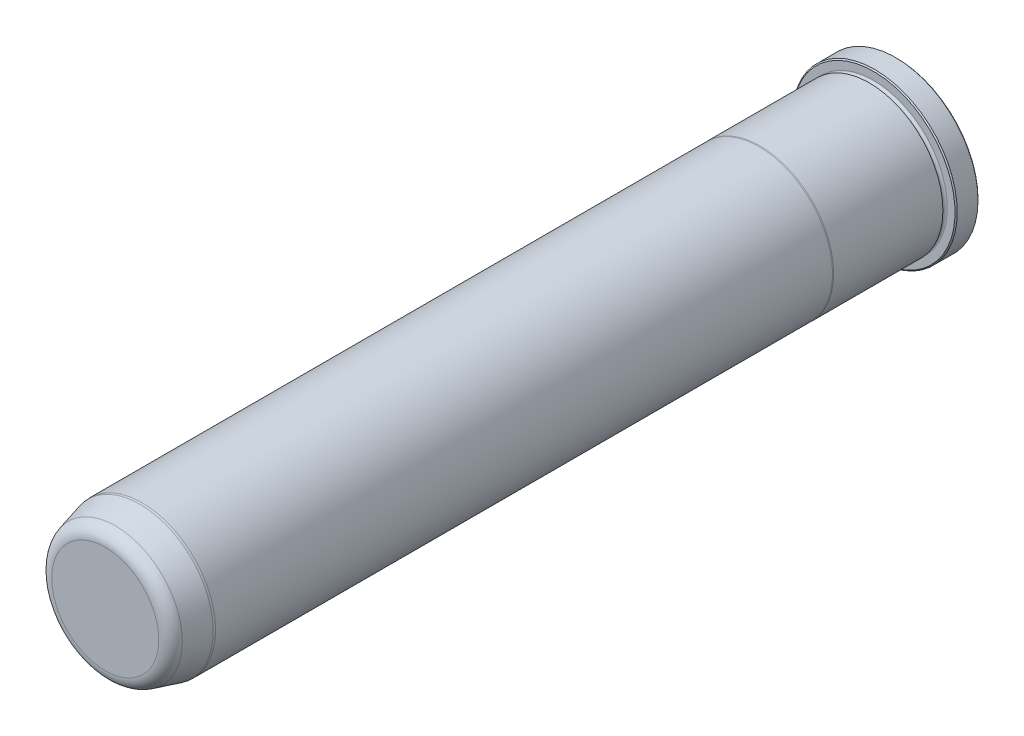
SolidWorks part; units mm, degrees
ref_plane "Front Plane" through (0, 0, 0) normal (0, 0, 1) x (1, 0, 0)
ref_plane "Top Plane" through (0, 0, 0) normal (0, 1, 0) x (1, 0, 0)
ref_plane "Right Plane" through (0, 0, 0) normal (1, 0, 0) x (0, 0, -1)
sketch "Sketch1" plane through (0, 0, 0) normal (1, 0, 0) x (0, 0, -1)
  line L0 (0, 0) -> (0, 28.448)
  line L1 (0, 28.448) -> (-7.9248, 28.448)
  line L2 (-7.9248, 28.448) -> (-7.9248, 25.3873)
  line L3 (-7.9248, 24.6253) -> (-9.4488, 24.6253) construction
  line L4 (-9.4488, 25.3873) -> (-9.4488, 25.4127)
  line L5 (-9.4488, 25.4127) -> (-47.1348, 25.4127)
  line L6 (-47.1348, 25.4127) -> (-47.498, 25.3873)
  line L7 (-47.498, 25.3873) -> (-260.35, 25.3873)
  line L9 (-273.05, 22.1219) -> (-273.05, 0)
  line L10 (-273.05, 0) -> (0, 0)
  line L11 (0, 0) -> (13.6287, 0) construction
  line L12 (-260.35, 25.3873) -> (-261.112, 25.3206)
  line L13 (-261.112, 25.3206) -> (-273.05, 22.1219)
  arc A0 (-9.4488, 25.3873) -> (-7.9248, 25.3873) centre (-8.6868, 25.3873) ccw
  dimension "D14" = 1.524
  dimension "D1" = 7.9248
  dimension "D2" = 1.524
  dimension "D3" = 56.896
  dimension "D4" = 50.8254
  dimension "D5" = 47.498
  dimension "D6" = 273.05
  dimension "D7" = 0.7874
  dimension "D8" = 4
  dimension "D9" = 50.7746
  dimension "D10" = 5
  dimension "D11" = 15
  dimension "D12" = 0.762
  dimension "D13" = 12.7
revolve "Revolve1" add sketch "Sketch1" angle 360 about L11
fillet "Fillet6" radius 4.7625 1 edges at (22.1219, 0, 273.05)
chamfer "Chamfer1" distance 0.381 angle 45 2 edges at (28.448, 0, 0) (28.448, 0, 7.9248)
